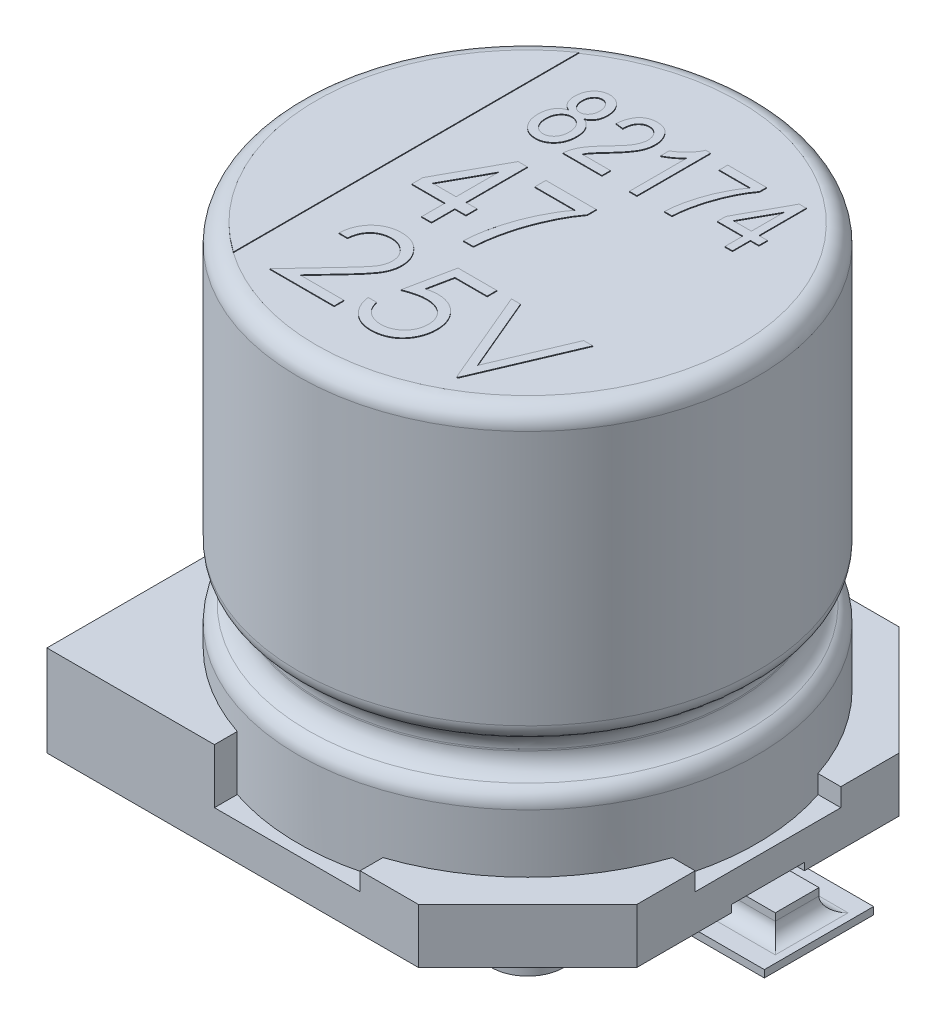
SolidWorks part; units mm, degrees
ref_plane "Plan de face" through (0, 0, 0) normal (0, 0, 1) x (1, 0, 0)
ref_plane "Plan de dessus" through (0, 0, 0) normal (0, 1, 0) x (1, 0, 0)
ref_plane "Plan de droite" through (0, 0, 0) normal (1, 0, 0) x (0, 0, -1)
sketch "Esquisse1" plane through (0, 0, 0) normal (0, 1, 0) x (1, 0, 0)
  circle A0 centre (0, 0) radius 3.15
  dimension "D1" = 6.3
extrude "Boss.-Extru.1" add sketch "Esquisse1" along normal blind 1.3
fillet "Congé1" radius 0.25 1 edges at (0, 1.3, 3.15)
sketch "Esquisse2" plane through (0, 1.3, 0) normal (0, 1, 0) x (1, 0, 0)
  circle A0 centre (0, 0) radius 2.85
  dimension "D1" = 5.7
extrude "Boss.-Extru.2" add sketch "Esquisse2" along normal blind 0.5
fillet "Congé2" radius 0.3 1 edges at (0, 1.3, 2.85)
sketch "Esquisse3" plane through (0, 1.8, 0) normal (0, 1, 0) x (1, 0, 0)
  circle A0 centre (0, 0) radius 3.15
  dimension "D1" = 6.3
extrude "Boss.-Extru.3" add sketch "Esquisse3" along normal blind 4
fillet "Congé3" radius 0.25 1 edges at (0, 1.8, 3.15)
fillet "Congé4" radius 0.3 1 edges at (0, 1.8, 2.85)
fillet "Congé5" radius 0.25 1 edges at (0, 5.8, 3.15)
sketch "Esquisse4" plane through (0, 0, 0) normal (0, -1, 0) x (1, 0, 0)
  line L0 (1.8, -3.3) -> (3.3, -1.8)
  line L1 (-3.3, 3.3) -> (1.8, 3.3)
  line L2 (-3.3, 3.3) -> (-3.3, -3.3)
  line L3 (-3.3, -3.3) -> (1.8, -3.3)
  line L4 (3.3, 1.8) -> (3.3, -1.8)
  line L5 (1.8, 3.3) -> (3.3, 1.8)
  point P1 (3.3, -3.3)
  point P3 (3.3, 3.3)
  point P4 (-3.3, 0)
  dimension "D1" = 6.6
  dimension "D2" = 6.6
extrude "Boss.-Extru.4" add sketch "Esquisse4" along normal blind 0.5
sketch "Esquisse5" plane through (0, 0, 0) normal (0, 1, 0) x (1, 0, 0)
  line L0 (1.8, 3.3) -> (1, 3.3)
  line L1 (-3.3, 3.3) -> (1.8, 3.3) construction
  line L2 (1, 3.3) -> (1, 2.9871)
  line L3 (1.8, 3.3) -> (3.3, 1.8)
  line L4 (3.3, 1.8) -> (3.3, 1)
  line L5 (3.3, 1.8) -> (3.3, -1.8) construction
  line L6 (3.3, 1) -> (2.9871, 1)
  line L7 (1, -3.3) -> (1.8, -3.3)
  line L8 (1.8, -3.3) -> (-3.3, -3.3) construction
  line L9 (1.8, -3.3) -> (3.3, -1.8)
  line L10 (3.3, -1.8) -> (3.3, -1)
  line L11 (3.3, -1) -> (2.9871, -1)
  line L12 (1, -3.3) -> (1, -2.9871)
  circle A0 centre (0, 0) radius 3.15 construction
  arc A1 (1, 2.9871) -> (2.9871, 1) centre (0, 0) cw
  arc A2 (1, -2.9871) -> (2.9871, -1) centre (0, 0) ccw
  dimension "D1" = 2.3
  dimension "D2" = 2.3
  dimension "D3" = 2.3
  dimension "D4" = 2.3
extrude "Boss.-Extru.5" add sketch "Esquisse5" along normal blind 0.25
sketch "Esquisse6" plane through (0, 0, 0) normal (0, 1, 0) x (1, 0, 0)
  line L0 (-1, 3.3) -> (-3.3, 3.3)
  line L1 (-3.3, 3.3) -> (1, 3.3) construction
  line L2 (-3.3, 3.3) -> (-3.3, 1)
  line L3 (-3.3, -3.3) -> (-3.3, 3.3) construction
  line L4 (-3.3, 1) -> (-2.9871, 1)
  line L5 (-1, 3.3) -> (-1, 2.9871)
  line L6 (-1, -2.9871) -> (-1, -3.3)
  line L7 (1, -3.3) -> (-3.3, -3.3) construction
  line L8 (-1, -3.3) -> (-3.3, -3.3)
  line L9 (-3.3, -3.3) -> (-3.3, -1)
  line L10 (-3.3, -1) -> (-2.9871, -1)
  arc A0 (1, 2.9871) -> (1, -2.9871) centre (0, 0) ccw construction
  arc A1 (-2.9871, 1) -> (-1, 2.9871) centre (0, 0) cw
  arc A2 (-2.9871, -1) -> (-1, -2.9871) centre (0, 0) ccw
  dimension "D1" = 2.3
  dimension "D2" = 2.3
  dimension "D3" = 2.3
extrude "Boss.-Extru.6" add sketch "Esquisse6" along normal blind 0.75
sketch "Esquisse7" plane through (0, -0.5, 0) normal (0, -1, 0) x (1, 0, 0)
  line L0 (1.8, 3.3) -> (-3.3, 3.3) construction
  line L1 (-3.3, 3.3) -> (-3.3, -3.3) construction
  line L2 (3.3, -1.8) -> (3.3, 1.8) construction
  line L4 (-3.3, -3.3) -> (1.8, -3.3) construction
  circle A0 centre (-2, 2) radius 0.5
  circle A1 centre (2, 2) radius 0.5
  circle A2 centre (2, -2) radius 0.5
  circle A3 centre (-2, -2) radius 0.5
  dimension "D1" = 1
  dimension "D2" = 1.3
  dimension "D3" = 1.3
  dimension "D4" = 1.3
  dimension "D5" = 1.3
extrude "Boss.-Extru.7" add sketch "Esquisse7" along normal blind 0.3
sketch "Esquisse8" plane through (0, -0.5, 0) normal (0, -1, 0) x (1, 0, 0)
  line L0 (-1.8, 0.5) -> (-3.3, 0.5)
  line L1 (-3.3, 3.3) -> (-3.3, -3.3) construction
  line L2 (-3.3, 0.5) -> (-3.3, -0.5)
  line L3 (-3.3, -0.5) -> (-1.8, -0.5)
  line L4 (1.8, -0.5) -> (3.3, -0.5)
  line L5 (3.3, -1.8) -> (3.3, 1.8) construction
  line L6 (3.3, -0.5) -> (3.3, 0.5)
  line L7 (3.3, 0.5) -> (1.8, 0.5)
  arc A0 (-1.8, 0.5) -> (-1.8, -0.5) centre (-1.8, 0) cw
  arc A1 (1.8, 0.5) -> (1.8, -0.5) centre (1.8, 0) ccw
  dimension "D1" = 1
  dimension "D2" = 1.5
extrude "Enlèv. mat.-Extru.1" cut sketch "Esquisse8" against normal blind 0.1
sketch "Esquisse9" plane through (0, -0.4, 0) normal (0, -1, 0) x (1, 0, 0)
  line L0 (-1.8, 0.3) -> (-3.7, 0.3)
  line L1 (-3.7, 0.3) -> (-3.7, -0.3)
  line L2 (-3.7, -0.3) -> (-1.8, -0.3)
  line L3 (1.8, 0.3) -> (3.7, 0.3)
  line L4 (3.7, 0.3) -> (3.7, -0.3)
  line L5 (3.7, -0.3) -> (1.8, -0.3)
  line L6 (-3.3, -0.5) -> (-3.3, -3.3) construction
  line L7 (3.3, -1.8) -> (3.3, -0.5) construction
  arc A0 (-1.8, 0.3) -> (-1.8, -0.3) centre (-1.8, 0) cw
  arc A1 (1.8, 0.3) -> (1.8, -0.3) centre (1.8, 0) ccw
  dimension "D1" = 0.6
  dimension "D2" = 0.4
  dimension "D3" = 0.4
extrude "Boss.-Extru.8" add sketch "Esquisse9" along normal blind 0.3
sketch "Esquisse10" plane through (0, -0.7, 0) normal (0, -1, 0) x (1, 0, 0)
  line L1 (-4, 0.75) -> (-2, 0.75)
  line L2 (-4, 0.75) -> (-4, -0.75)
  line L3 (-4, -0.75) -> (-2, -0.75)
  line L4 (-2, 0.75) -> (-2, -0.75)
  line L5 (4, 0.75) -> (2, 0.75)
  line L6 (4, 0.75) -> (4, -0.75)
  line L7 (4, -0.75) -> (2, -0.75)
  line L8 (2, 0.75) -> (2, -0.75)
  line L9 (-3.3, 3.3) -> (-3.3, 0.5) construction
  line L10 (3.3, 0.5) -> (3.3, 1.8) construction
  point P10 (-4, 0)
  dimension "D1" = 1.5
  dimension "D2" = 2
  dimension "D3" = 0.7
  dimension "D4" = 0.7
extrude "Boss.-Extru.9" add sketch "Esquisse10" along normal blind 0.1
fillet "Congé6" radius 0.2 6 edges at (-2.85, -0.7, 0.3) (-2.85, -0.7, -0.3) (-3.7, -0.7, 0) (2.85, -0.7, -0.3) (3.7, -0.7, 0) (2.85, -0.7, 0.3)
sketch "Esquisse11" plane through (0, -0.7, 0) normal (0, -1, 0) x (1, 0, 0)
  line L0 (-1.8, 0.3) -> (-2, 0.3)
  line L1 (-2, -0.75) -> (-2, 0.75) construction
  line L2 (-1.8, 0.3) -> (-3.3, 0.3) construction
  line L3 (-2, 0.3) -> (-2, -0.3)
  line L4 (-2, -0.3) -> (-2, 0.3) construction
  line L5 (-2, -0.3) -> (-1.8, -0.3)
  line L6 (2, 0.3) -> (1.8, 0.3)
  line L7 (2, 0.3) -> (2, -0.3)
  line L8 (2, 0.75) -> (2, -0.75) construction
  line L9 (2, -0.3) -> (1.8, -0.3)
  arc A0 (-1.8, 0.3) -> (-1.8, -0.3) centre (-1.8, 0) cw
  arc A1 (1.8, 0.3) -> (1.8, -0.3) centre (1.8, 0) ccw
extrude "Boss.-Extru.10" add sketch "Esquisse11" along normal blind 0.1
sketch "Esquisse12" plane through (0, 5.8, 0) normal (0, 1, 0) x (1, 0, 0)
  line L0 (-1.668, 2.3723) -> (-1.668, -2.3723)
  line L1 (-1.268, 1.0676) -> (2.1053, 1.0676) construction
  line L2 (-1.268, -0.6595) -> (1.9304, -0.6595) construction
  line L3 (-1.268, -2.3211) -> (1.7045, -2.3211) construction
  circle A0 centre (0, 0) radius 2.9 construction
  arc A1 (-1.668, -2.3723) -> (-1.668, 2.3723) centre (0, 0) cw
  text T0 "82174" font "Arial Narrow" height 1
  text T1 "47" font "Arial Narrow" height 1.3
  text T2 "25V" font "Century Gothic" height 1.3
  dimension "D1" = 0.4
extrude "Boss.-Extru.11" add sketch "Esquisse12" along normal blind 0.01
